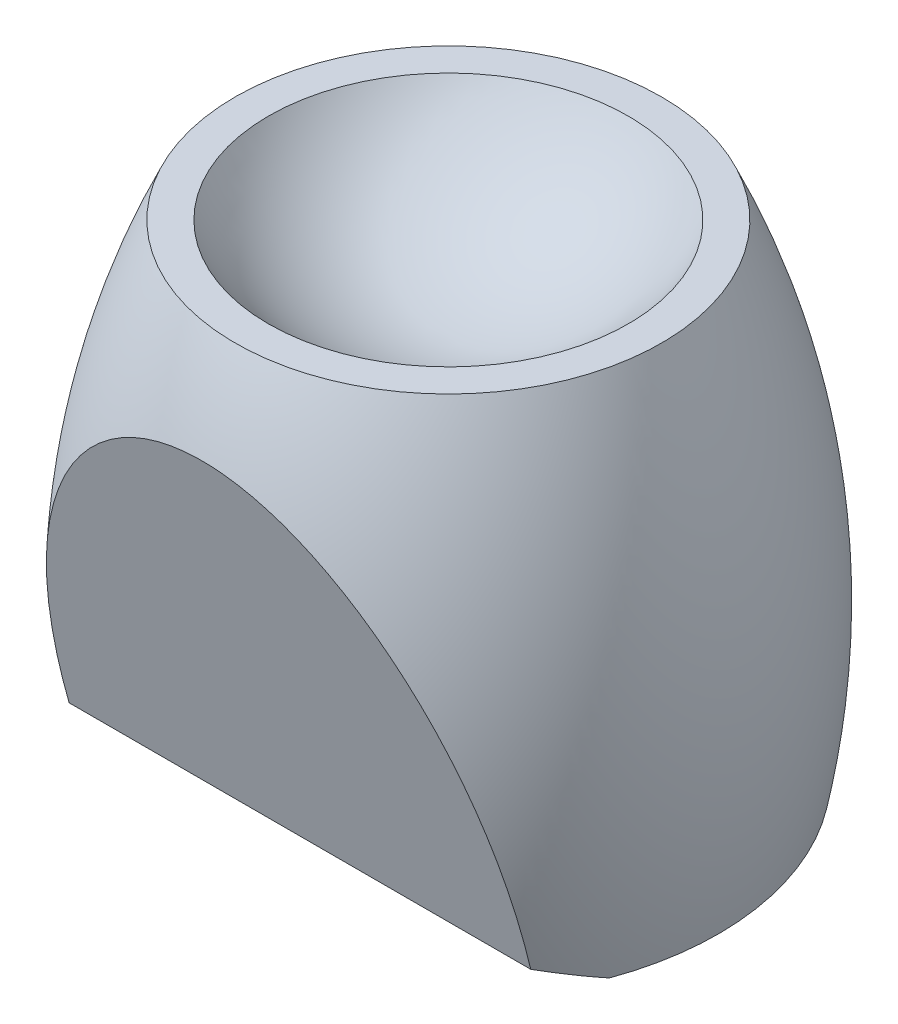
SolidWorks part; units mm, degrees
ref_plane "Přední" through (0, 0, 0) normal (0, 0, 1) x (1, 0, 0)
ref_plane "Horní" through (0, 0, 0) normal (0, 1, 0) x (1, 0, 0)
ref_plane "Pravá" through (0, 0, 0) normal (1, 0, 0) x (0, 0, -1)
sketch "Skica1" plane through (0, 0, 0) normal (0, 0, 1) x (1, 0, 0)
  line L0 (0, 0) -> (0, 195.5)
  line L1 (0, 195.5) -> (86.25, 195.5)
  line L2 (0, 0) -> (109.25, 0)
  line L3 (0, 195.5) -> (0, 242.746) construction
  arc A0 (86.25, 195.5) -> (109.25, 0) centre (-204.652, 62.1733) cw
  dimension "D4" = 320
  dimension "D1" = 195.5
  dimension "D2" = 172.5
  dimension "D3" = 218.5
revolve "Otočit kolem osy1" add sketch "Skica1" angle 360 about L3
sketch "Skica2" plane through (0, 0, 0) normal (1, 0, 0) x (0, 0, -1)
  line L0 (-57.5, 0) -> (-99.7051, 161)
  line L1 (-109.25, 0) -> (109.25, 0) construction
  line L2 (86.25, 195.5) -> (-86.25, 195.5) construction
  arc A0 (-86.25, 195.5) -> (-109.25, 0) centre (204.652, 62.1733) ccw construction
  dimension "D1" = 57.5
  dimension "D2" = 34.5
sketch "Skica3" plane through (0, 0, 0) normal (0, -1, 0) x (1, 0, 0)
  line L0 (0, 57.5) -> (42.8096, 57.5)
ref_plane "Rovina1" through (0, -14.104, 53.8027) normal (0, 0.2536, -0.9673) x (-1, 0, 0)
other "Odebrat povrchem1"
sketch "Skica4" plane through (0, 0, 0) normal (1, 0, 0) x (0, 0, -1)
  line L0 (92.271, 0) -> (112.6004, 20.3293)
  line L1 (-57.5, 0) -> (109.25, 0) construction
  line L2 (0, 55) -> (0, -55) construction
  arc A0 (109.25, 0) -> (86.25, 195.5) centre (-204.652, 62.1733) ccw construction
  dimension "D1" = 28.75
  dimension "D2" = 45
sketch "Skica5" plane through (0, 0, 0) normal (0, -1, 0) x (1, 0, 0)
  line L0 (0, -92.271) -> (-22.4335, -92.271)
ref_plane "Rovina2" through (0, -46.1355, -46.1355) normal (0, 0.7071, 0.7071) x (-1, 0, 0)
other "Odebrat povrchem2"
sketch "Skica6" plane through (0, 0, 0) normal (0, 0, 1) x (1, 0, 0)
  line L0 (74.75, -37.375) -> (74.75, 11.5)
  line L2 (123.625, -37.375) -> (74.75, -37.375)
  line L3 (-92.8941, 0) -> (92.8941, 0) construction
  arc A0 (74.75, 11.5) -> (123.625, -37.375) centre (74.75, -37.375) cw
  dimension "D1" = 48.875
  dimension "D2" = 11.5
  dimension "D3" = 74.75
revolve "Odebrat otočením1" cut sketch "Skica6" angle 360 about L0
mirror "Zrcadlit1" about plane through (0, 0, 0) normal (1, 0, 0) of "Odebrat otočením1"
sketch "Skica7" plane through (0, 0, 0) normal (0, 0, 1) x (1, 0, 0)
  line L0 (0, 155.5) -> (0, 241.75)
  line L1 (0, 241.75) -> (-86.25, 241.75)
  line L2 (0, 155.5) -> (61.6332, 155.5) construction
  line L3 (0, 155.5) -> (0, 168.6659) construction
  line L4 (86.25, 195.5) -> (-86.25, 195.5) construction
  arc A0 (-86.25, 241.75) -> (0, 155.5) centre (0, 241.75) ccw
  dimension "D1" = 172.5
  dimension "D2" = 40
revolve "Odebrat otočením2" cut sketch "Skica7" angle 360 about L0
chamfer "Zkosit1" distance 20 distance2 10 1 edges at (0, 0, 57.5)
